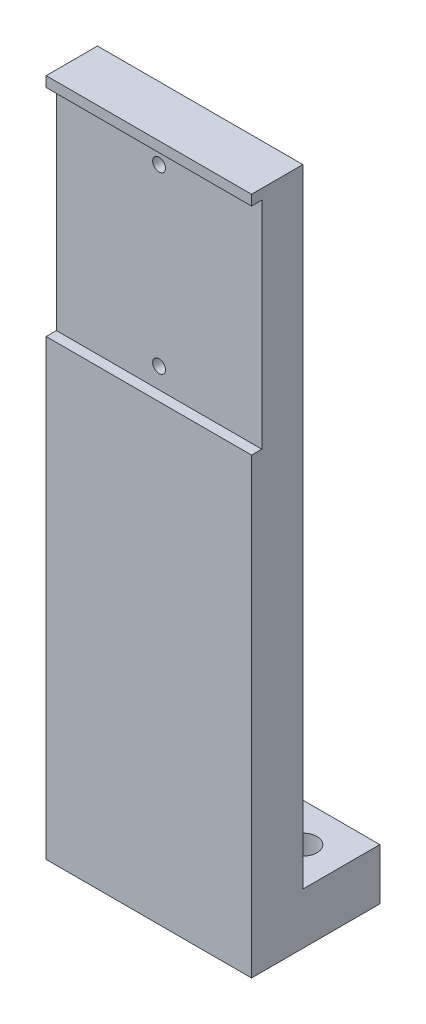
SolidWorks part; units mm, degrees
ref_plane "前视基准面" through (0, 0, 0) normal (0, 0, 1) x (1, 0, 0)
ref_plane "上视基准面" through (0, 0, 0) normal (0, 1, 0) x (1, 0, 0)
ref_plane "右视基准面" through (0, 0, 0) normal (1, 0, 0) x (0, 0, -1)
sketch "草图1" plane through (0, 0, 0) normal (0, 0, 1) x (1, 0, 0)
  line L0 (0, 0) -> (0, 132.2)
  line L1 (40, 0) -> (40, 132.2)
  line L2 (0, 0) -> (40, 0)
  line L3 (0, 132.2) -> (40, 132.2)
  circle A0 centre (20, 92.2) radius 1.25
  circle A1 centre (20, 126.2) radius 1.25
extrude "凸台-拉伸1" add sketch "草图1" along normal blind 25
sketch "草图2" plane through (40, 0, 0) normal (1, 0, 0) x (0, 0, -1)
  line L0 (-23, 88.2037) -> (-23, 130.2037)
  line L1 (-25, 0.0037) -> (-25, 88.2037)
  line L2 (-15, 10.0037) -> (-15, 132.2037)
  line L3 (0, 0.0037) -> (0, 10.0037)
  line L4 (-25, 88.2037) -> (-23, 88.2037)
  line L5 (-25, 130.2037) -> (-23, 130.2037)
  line L6 (-25, 0.0037) -> (0, 0.0037)
  line L7 (-25, 132.2037) -> (-15, 132.2037)
  line L8 (-15, 10.0037) -> (0, 10.0037)
  line L9 (-25, 130.2037) -> (-25, 132.2037)
extrude "切除-拉伸1" cut sketch "草图2" against normal through all flip side to cut
sketch "草图3" plane through (0, 10.0037, 0) normal (0, 1, 0) x (1, 0, 0)
  circle A0 centre (7.5, -7.5) radius 2.75
  circle A1 centre (32.5, -7.5) radius 2.75
extrude "切除-拉伸2" cut sketch "草图3" against normal blind 25
